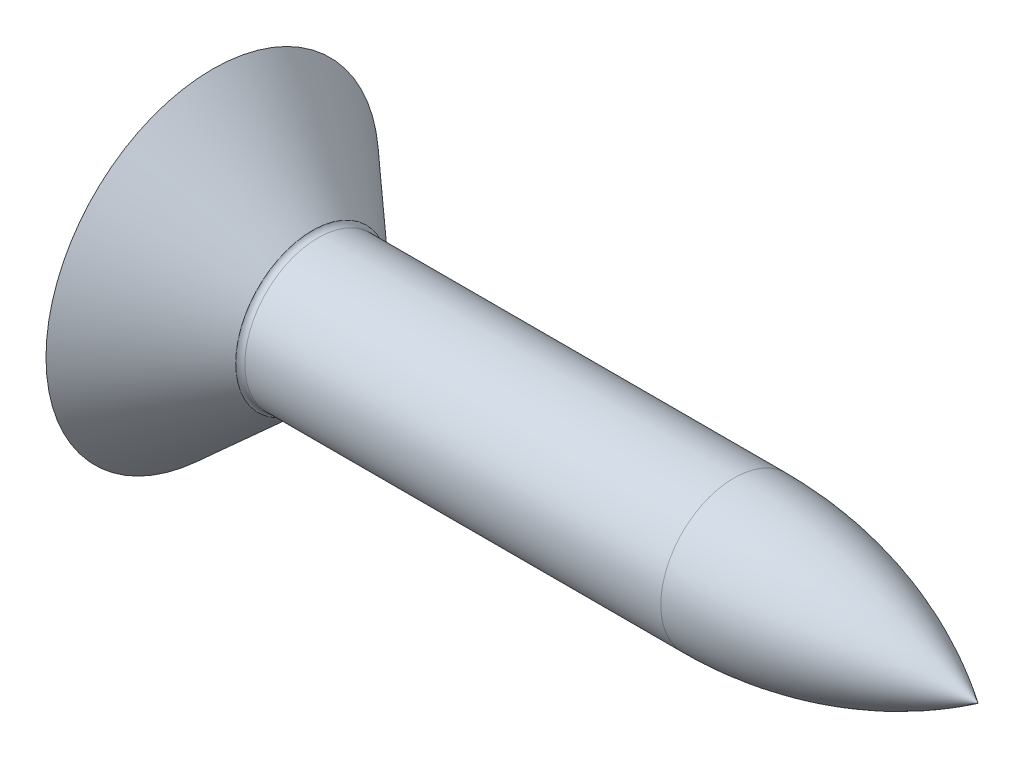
SolidWorks part; units mm, degrees
ref_plane "Plane1" through (0, 0, 0) normal (0, 0, 1) x (1, 0, 0)
ref_plane "Plane2" through (0, 0, 0) normal (0, 1, 0) x (1, 0, 0)
ref_plane "Plane3" through (0, 0, 0) normal (1, 0, 0) x (0, 0, -1)
sketch "BodySke" plane through (0, 0, 0) normal (0, 0, 1) x (1, 0, 0)
  line L0 (1.5, 1.1) -> (1.5, 1.15)
  line L1 (1.725, 6.35) -> (1.725, -3.175) construction
  line L2 (-25.4, 0) -> (127, 0) construction
  line L3 (11.5, 0) -> (0, 0)
  line L4 (1.5, 1.1) -> (7.8354, 1.1)
  line L5 (0, 0) -> (0, 2.5)
  line L6 (0, 2.5) -> (1.5, 1.15)
  line L8 (2.1, 6.35) -> (2.1, -3.175) construction
  arc A1 (11.5, 0) -> (7.8354, 1.1) centre (7.8354, -5.5544) ccw
  point P19 (1.5, 2.5)
  dimension "D3" = 0.05
  dimension "D1" = 1.1
  dimension "D2" = 10
  dimension "Head_ht" = 1.5
  dimension "Advance" = 0.45
revolve "Base-Revolve" add sketch "BodySke"
fillet "Fillet1" radius 0.1 1 edges at (1.5, 0, 1.1)
sketch "Sketch3" plane through (0, 0, 0) normal (1, 0, 0) x (0, 0, -1)
  line L0 (0.37, -1.3) -> (-0.37, -1.3)
  line L1 (0.37, -1.3) -> (0.37, 1.3)
  line L2 (-0.37, 1.3) -> (0.37, 1.3)
  line L3 (-0.37, 1.3) -> (-0.37, -1.3)
  dimension "D1" = 1.3
  dimension "Cross_dia" = 2.6
  dimension "D2" = 0.37
  dimension "Cross_width" = 0.74
ref_plane "Plane4" through (1.5, 0, 0) normal (1, 0, 0) x (0, 0, -1)
sketch "Sketch4" plane through (1.5, 0, 0) normal (1, 0, 0) x (0, 0, -1)
  line L0 (0.37, -0.5521) -> (-0.37, -0.5521)
  line L1 (0.37, -0.5521) -> (0.37, 0.5521)
  line L2 (-0.37, 0.5521) -> (0.37, 0.5521)
  line L3 (-0.37, 0.5521) -> (-0.37, -0.5521)
  dimension "D1" = 0.74
  dimension "D2" = 1.1043
  dimension "D3" = 0.37
  dimension "D4" = 0.5521
loft "Recess" cut profiles "Sketch3", "Sketch4"
pattern_circular "RecPat" count 2 every 90 about axis through (0, 0, 0) along (1, 0, 0) of "Recess"
sketch "RecCorSke" plane through (0, 0, 0) normal (0, 0, 1) x (1, 0, 0)
  line L0 (-3.175, 0) -> (15.875, 0) construction
  line L1 (-25.4, 0) -> (127, 0) construction
  line L2 (0, 0) -> (0, 0.6609)
  line L3 (0, 0.6609) -> (1.5, 0.556)
  line L4 (1.5, 0.556) -> (1.6807, 0)
  line L5 (1.6807, 0) -> (0, 0)
  dimension "Diameter" = 1.112
  dimension "Depth" = 1.5
  dimension "Draft_angle" = 4
  dimension "Bottom_angle" = 18
revolve "RecessCore" cut sketch "RecCorSke" angle 360 about L0
sketch "ThdSchSke" plane through (0, 0, 0) normal (0, 0, 1) x (1, 0, 0)
  line L0 (3, -0.9965) -> (2.8225, -1.25)
  line L1 (3, -0.9965) -> (3.1775, -1.25)
  line L2 (3.1775, -1.25) -> (3.1775, -1.5625)
  line L3 (-3.175, 0) -> (5.1513, 0) construction
  line L5 (3.1775, -1.5625) -> (2.8225, -1.5625)
  line L6 (2.8225, -1.5625) -> (2.8225, -1.25)
  dimension "Thread_minor" = 1.993
  dimension "Diameter" = 2.5
  dimension "Start" = 3
  dimension "SideAngle" = 55
  dimension "VeeAngle" = 70
  dimension "Overcut" = 3.125
revolve "ThreadSchematic" cut sketch "ThdSchSke" angle 360 about L3
pattern_linear "ThdSchPat"
